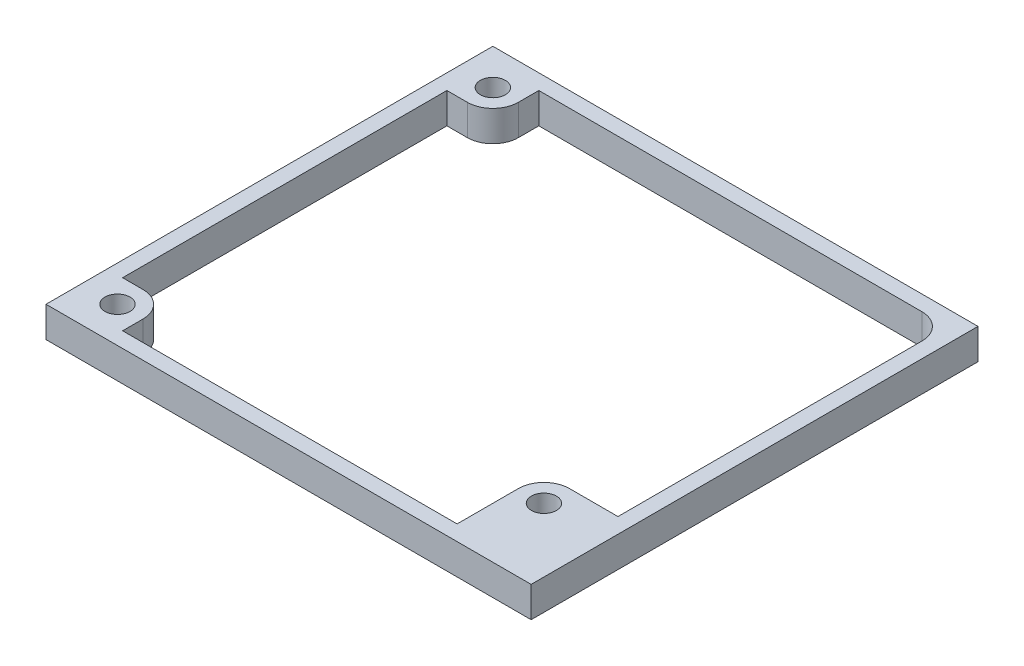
SolidWorks part; units mm, degrees
ref_plane "Front Plane" through (0, 0, 0) normal (0, 0, 1) x (1, 0, 0)
ref_plane "Top Plane" through (0, 0, 0) normal (0, 1, 0) x (1, 0, 0)
ref_plane "Right Plane" through (0, 0, 0) normal (1, 0, 0) x (0, 0, -1)
sketch "Sketch1" plane through (0, 0, 0) normal (0, 1, 0) x (1, 0, 0)
  line L4 (48.514, 7.239) -> (48.514, 40.005)
  line L5 (1.778, -2.921) -> (50.038, -2.921)
  line L6 (1.778, -2.921) -> (1.778, 41.529)
  line L7 (1.778, 41.529) -> (50.038, 41.529)
  line L8 (50.038, -2.921) -> (50.038, 41.529)
  line L10 (7.874, 37.973) -> (7.874, 40.005)
  line L11 (5.334, 35.433) -> (3.302, 35.433)
  line L14 (43.688, 7.239) -> (48.514, 7.239)
  line L15 (41.148, 4.699) -> (41.148, -1.397)
  line L16 (7.874, 0.635) -> (7.874, -1.397)
  line L17 (5.334, 3.175) -> (3.302, 3.175)
  line L18 (7.874, -1.397) -> (41.148, -1.397)
  line L19 (3.302, 3.175) -> (3.302, 35.433)
  line L20 (7.874, 40.005) -> (48.514, 40.005)
  circle A2 centre (5.334, 0.635) radius 1.2446
  circle A3 centre (5.334, 37.973) radius 1.2446
  circle A5 centre (43.688, 4.699) radius 1.2446
  arc A6 (5.334, 35.433) -> (7.874, 37.973) centre (5.334, 37.973) ccw
  arc A8 (43.688, 7.239) -> (41.148, 4.699) centre (43.688, 4.699) ccw
  arc A9 (7.874, 0.635) -> (5.334, 3.175) centre (5.334, 0.635) ccw
  point P0 (49.022, 40.3158)
  dimension "D1" = 2.4892
  dimension "D13" = 5.08
  dimension "D8" = 1.524
  dimension "D2" = 48.26
  dimension "D3" = 44.45
  dimension "D4" = 7.62
  dimension "D5" = 3.556
  dimension "D6" = 3.556
  dimension "D7" = 3.556
  dimension "D9" = 1.524
  dimension "D10" = 1.524
  dimension "D11" = 1.524
  dimension "D12" = 6.35
extrude "Boss-Extrude2" add sketch "Sketch1" along normal blind 3.048
fillet "Fillet1" radius 2.54 1 edges at (48.514, 1.524, -40.005)
